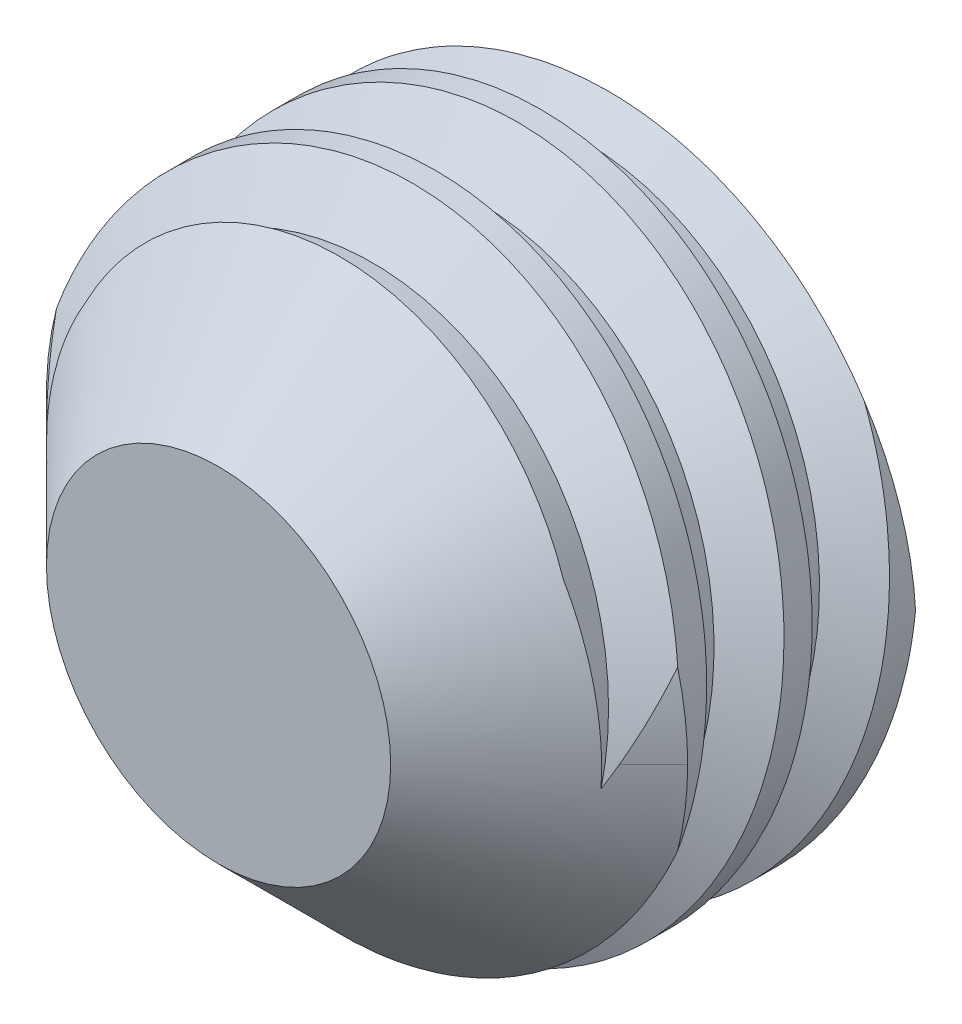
SolidWorks part; units mm, degrees
other "<SSS1032-0125ZB_94105A824>-<Imported1>"
ref_plane "Front Plane" through (0, 0, 0) normal (0, 0, 1) x (1, 0, 0)
ref_plane "Top Plane" through (0, 0, 0) normal (0, 1, 0) x (1, 0, 0)
ref_plane "Right Plane" through (0, 0, 0) normal (1, 0, 0) x (0, 0, -1)
mirrored part "SSS1032-0125ZB_94105A824_Mirrored"
